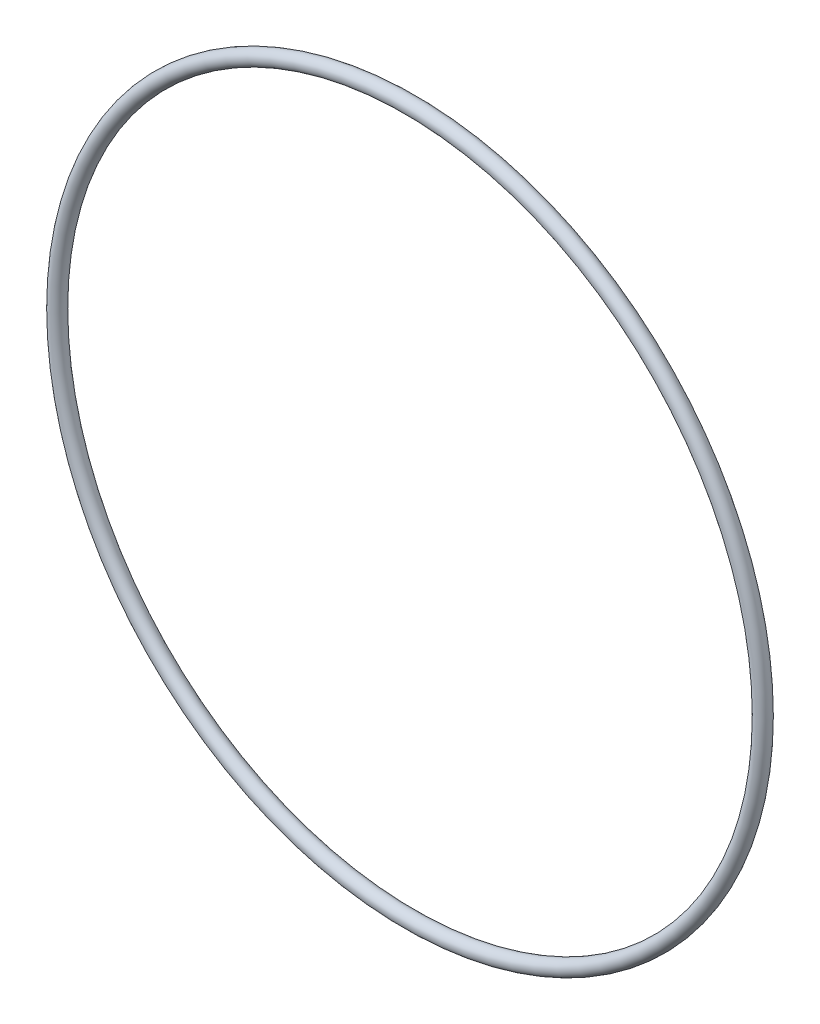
SolidWorks part; units mm, degrees
ref_plane "Front Plane" through (0, 0, 0) normal (0, 0, 1) x (1, 0, 0)
ref_plane "Top Plane" through (0, 0, 0) normal (0, 1, 0) x (1, 0, 0)
ref_plane "Right Plane" through (0, 0, 0) normal (1, 0, 0) x (0, 0, -1)
sketch "Sketch1" plane through (0, 0, 0) normal (0, 1, 0) x (1, 0, 0)
  circle A0 centre (0, 0) radius 0.889
  dimension "D1" = 1.778
sketch "Sketch3" plane through (0, 0, 0) normal (0, 0, 1) x (1, 0, 0)
  circle A0 centre (42.0243, 0) radius 42.0243
  dimension "D1" = 84.0486
sweep "Sweep1" add profiles "Sketch1" path "Sketch3"
